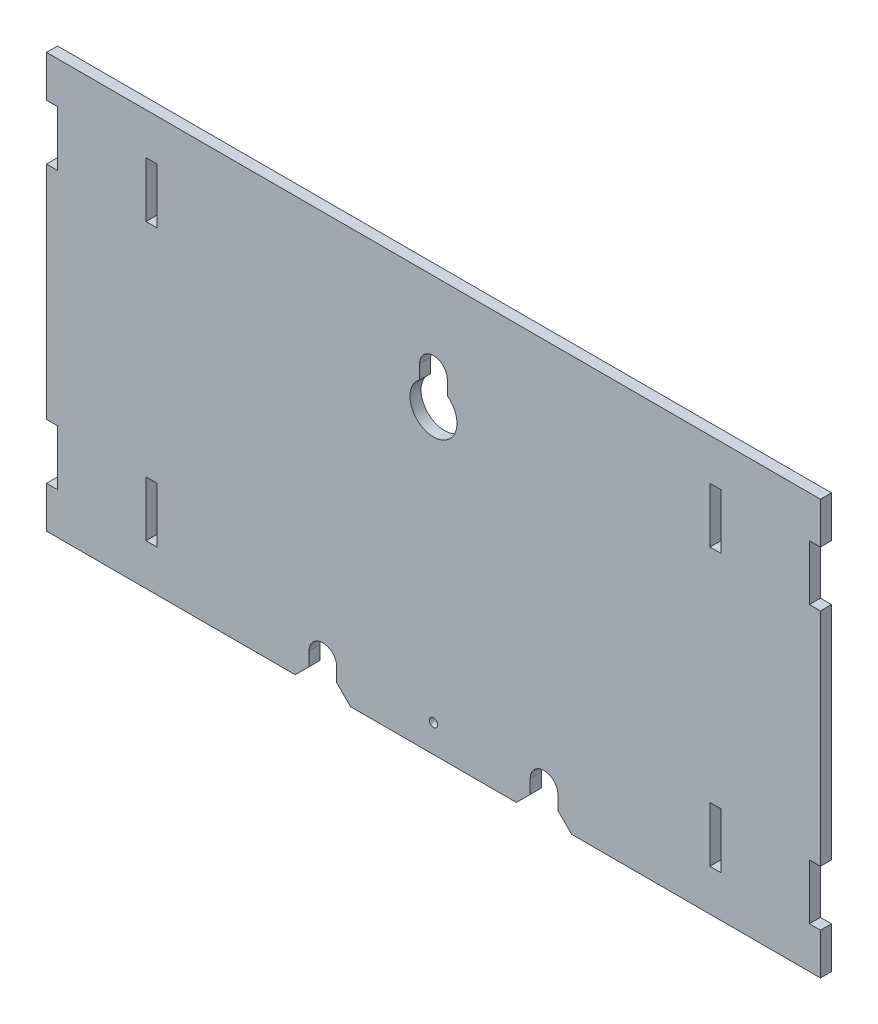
SolidWorks part; units mm, degrees
ref_plane "Front Plane" through (0, 0, 0) normal (0, 0, 1) x (1, 0, 0)
ref_plane "Top Plane" through (0, 0, 0) normal (0, 1, 0) x (1, 0, 0)
ref_plane "Right Plane" through (0, 0, 0) normal (1, 0, 0) x (0, 0, -1)
sketch "Sketch1" plane through (0, 0, 0) normal (0, 0, 1) x (1, 0, 0)
  line L0 (-100, 35) -> (-100, 15)
  line L1 (-140, 150) -> (140, 150)
  line L2 (-140, 150) -> (-140, 135)
  line L3 (-140, 0) -> (-45, 0)
  line L4 (140, 150) -> (140, 135)
  line L5 (-104, 135) -> (-100, 135)
  line L6 (-104, 135) -> (-104, 115)
  line L7 (-104, 15) -> (-100, 15)
  line L8 (-100, 135) -> (-100, 115)
  line L9 (-104, 115) -> (-100, 115)
  line L10 (-104, 35) -> (-104, 15)
  line L11 (-104, 35) -> (-100, 35)
  line L12 (100, 35) -> (100, 15)
  line L13 (100, 135) -> (104, 135)
  line L14 (100, 135) -> (100, 115)
  line L15 (100, 15) -> (104, 15)
  line L16 (104, 135) -> (104, 115)
  line L17 (100, 115) -> (104, 115)
  line L18 (104, 35) -> (104, 15)
  line L19 (100, 35) -> (104, 35)
  line L20 (0, 0) -> (-100, 15) construction
  line L21 (0, 0) -> (100, 15) construction
  line L22 (140, 115) -> (140, 35)
  line L23 (140, 135) -> (136, 135)
  line L24 (-40, -2) -> (40, -2) construction
  line L25 (140, 115) -> (136, 115)
  line L26 (136, 135) -> (136, 115)
  line L27 (140, 35) -> (136, 35)
  line L28 (0, -2) -> (0, 108) construction
  line L29 (140, 15) -> (136, 15)
  line L30 (136, 35) -> (136, 15)
  line L31 (-140, 135) -> (-136, 135)
  line L32 (0, -2) -> (0, 0) construction
  line L33 (-140, 115) -> (-136, 115)
  line L34 (-136, 135) -> (-136, 115)
  line L35 (-140, 35) -> (-136, 35)
  line L36 (0, 108) -> (0, 120) construction
  line L37 (-140, 15) -> (-136, 15)
  line L38 (-136, 35) -> (-136, 15)
  line L39 (140, 15) -> (140, 0)
  line L40 (-140, 15) -> (-140, 0)
  line L41 (-140, 115) -> (-140, 35)
  line L42 (-5, 114.8739) -> (-5, 120)
  line L43 (5, 114.8739) -> (5, 120)
  line L44 (40, -2) -> (40, 10) construction
  line L46 (45, 0) -> (45, 10)
  line L47 (-40, -2) -> (-40, 10) construction
  line L48 (-45, 0) -> (-45, 10)
  line L49 (-35, 0) -> (-35, 10)
  line L50 (-40, 10) -> (0, 10) construction
  line L51 (0, 10) -> (40, 10) construction
  line L52 (-35, 0) -> (35, 0)
  line L53 (45, 0) -> (140, 0)
  line L54 (35, 0) -> (35, 10)
  arc A0 (-5, 114.8739) -> (5, 114.8739) centre (0, 108) ccw
  circle A1 centre (-40, -2) radius 8.5 construction
  circle A2 centre (40, -2) radius 8.5 construction
  arc A3 (5, 120) -> (-5, 120) centre (0, 120) ccw
  circle A4 centre (0, 10) radius 1.5
  arc A6 (45, 10) -> (35, 10) centre (40, 10) ccw
  arc A8 (-35, 10) -> (-45, 10) centre (-40, 10) ccw
  point P36 (0, 68)
  point P51 (40, -2)
  point P57 (-40, -2)
  dimension "D11" = 17
  dimension "D17" = 3
  dimension "D1" = 4
  dimension "D2" = 20
  dimension "D3" = 15
  dimension "D4" = 15
  dimension "D5" = 200
  dimension "D6" = 4
  dimension "D7" = 150
  dimension "D8" = 32
  dimension "D9" = 80
  dimension "D10" = 110
  dimension "D12" = 12
  dimension "D13" = 10
  dimension "D14" = 10
  dimension "D15" = 40
  dimension "D16" = 280
  dimension "D18" = 110
extrude "Extrude1" add sketch "Sketch1" along normal blind 4
chamfer "Chamfer1" distance 5 angle 45 4 edges at (45, 0, 2) (35, 0, 2) (-35, 0, 2) (-45, 0, 2)
